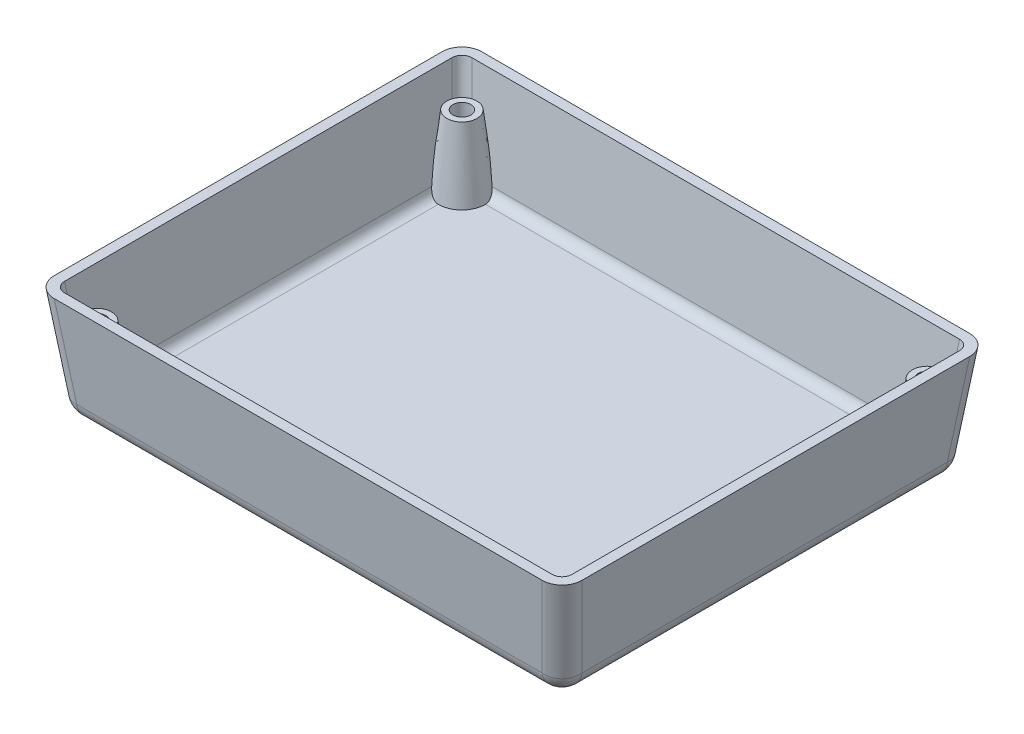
SolidWorks part; units mm, degrees
ref_plane "Front Plane" through (0, 0, 0) normal (0, 0, 1) x (1, 0, 0)
ref_plane "Top Plane" through (0, 0, 0) normal (0, 1, 0) x (1, 0, 0)
ref_plane "Right Plane" through (0, 0, 0) normal (1, 0, 0) x (0, 0, -1)
sketch "Sketch1"
  dimension "D1" = 101.6
  dimension "D2" = 127
extrude "Extrude1" add sketch "Sketch1" along normal blind 27.686 draft 7
fillet "Fillet1" radius 5.08 8 edges at (0, 0, 50.8) (63.5, 0, 0) (0, 0, -50.8) (-63.5, 0, 0) (65.1997, 13.843, 52.4997) (65.1997, 13.843, -52.4997) (-65.1997, 13.843, -52.4997) (-65.1997, 13.843, 52.4997)
shell "Shell1" thickness 2.54
ref_plane "Plane1" through (0, 20.32, 0) normal (0, 1, 0) x (-1, 0, 0)
sketch "Sketch3"
  dimension "D1" = 7.62
extrude "Extrude2" add sketch "Sketch3" against normal up to next draft 7
sketch "Sketch4"
  dimension "D1" = 4.572
extrude "Extrude3" cut sketch "Sketch4" against normal blind 12.7
sketch "Sketch2"
  dimension "D1" = 8.89
